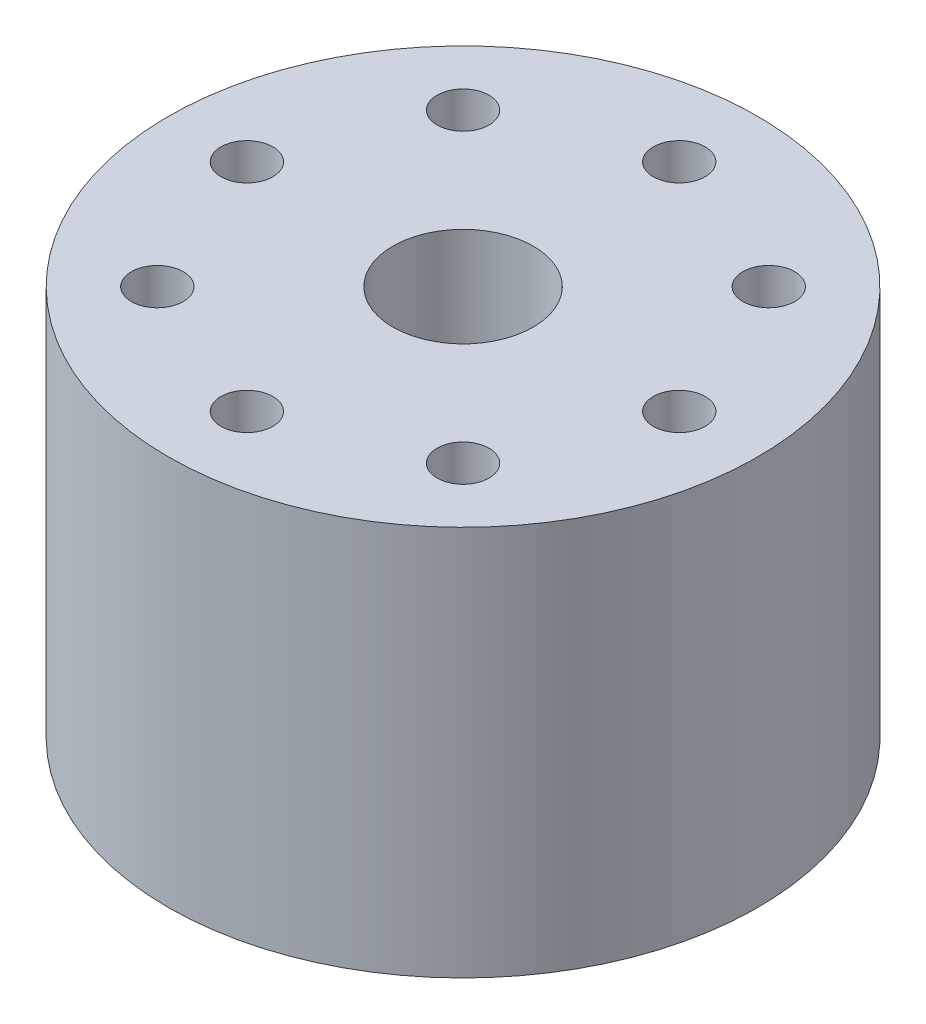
SolidWorks part; units mm, degrees
ref_plane "Front Plane" through (0, 0, 0) normal (0, 0, 1) x (1, 0, 0)
ref_plane "Top Plane" through (0, 0, 0) normal (0, 1, 0) x (1, 0, 0)
ref_plane "Right Plane" through (0, 0, 0) normal (1, 0, 0) x (0, 0, -1)
sketch "Sketch1" plane through (0, 0, 0) normal (0, 1, 0) x (1, 0, 0)
  circle A0 centre (0, 0) radius 37.5
  dimension "D1" = 75
extrude "Outer Cylinder" add sketch "Sketch1" along normal blind 49.65
sketch "Sketch2" plane through (0, 49.65, 0) normal (0, 1, 0) x (1, 0, 0)
  circle A0 centre (0, 0) radius 8.93
  dimension "D1" = 17.86
extrude "NPT Hole" cut sketch "Sketch2" against normal blind 23
sketch "Sketch3" plane through (0, 0, 0) normal (0, -1, 0) x (1, 0, 0)
  circle A0 centre (0, 0) radius 8
  dimension "D1" = 16
extrude "Outer Leaflet Diameter" cut sketch "Sketch3" against normal blind 5
sketch "Sketch4" plane through (0, 0, 0) normal (0, -1, 0) x (1, 0, 0)
  circle A0 centre (0, 0) radius 12
  dimension "D1" = 24
extrude "Depth" cut sketch "Sketch4" against normal blind 3.15
ref_plane "Plane1" through (0, 3.15, 0) normal (0, -1, 0) x (-1, 0, 0)
sketch "Sketch6" plane through (0, 0, 0) normal (0, 0, 1) x (1, 0, 0)
  line L0 (0, 3.15) -> (-8, 3.15)
  line L1 (-12, 3.15) -> (12, 3.15) construction
  line L2 (0, 3.15) -> (0, 14.51)
  line L3 (0, 14.51) -> (-8, 14.51)
  spline S0 degree 2 poles (-8, 14.51) (-12.8, 8.83) (-8, 3.15) knots 0 0 0 1 1 1
revolve "Aortic Root" cut sketch "Sketch6" angle 360 about L2
ref_plane "Plane3" through (0, 26.65, 0) normal (0, 1, 0) x (1, 0, 0)
ref_plane "Plane5" through (0, 14.51, 0) normal (0, -1, 0) x (-1, 0, 0)
sketch "Sketch8" plane through (0, 0, 0) normal (0, 0, 1) x (1, 0, 0)
  line L0 (0, 26.65) -> (0, 14.51)
  line L1 (8.93, 26.65) -> (-8.93, 26.65) construction
  line L2 (-8, 14.51) -> (8, 14.51) construction
  line L3 (0, 14.51) -> (-8, 14.51)
  line L4 (-8, 14.51) -> (-8, 26.65)
  line L5 (-8, 26.65) -> (0, 26.65)
revolve "Ascending Aorta" cut sketch "Sketch8" angle 360 about L0
sketch "Sketch9" plane through (0, 49.65, 0) normal (0, 1, 0) x (1, 0, 0)
  line L0 (0, 0) -> (0, -27.5) construction
  line L1 (0, 0) -> (-19.4454, -19.4454) construction
  circle A0 centre (0, -27.5) radius 3.3
  circle A1 centre (0, 0) radius 27.5
  circle A2 centre (-19.4454, -19.4454) radius 3.3
  circle A3 centre (-27.5, 0) radius 3.3
  circle A4 centre (-19.4454, 19.4454) radius 3.3
  circle A5 centre (0, 27.5) radius 3.3
  circle A6 centre (19.4454, 19.4454) radius 3.3
  circle A7 centre (27.5, 0) radius 3.3
  circle A8 centre (19.4454, -19.4454) radius 3.3
  dimension "D1" = 6.6
  dimension "D3" = 55
  dimension "D2" = 27.5
  dimension "D5" = 45
  dimension "D4" = 8
extrude "Bolt Holes" cut sketch "Sketch9" against normal through all contours A1 A8 | A1 A7 | A1 A6 | A1 A6 | A1 A5 | A1 A5 | A1 A4 | A1 A4 | A1 A3 | A1 A3 | A1 A2 | A1 A2 | A0 A1 | A1 A0 | A1 A8
chamfer "Chamfer1" distance 2 angle 70 1 edges at (-8, 26.65, 0)
equation "\"A\"= 16"
equation "\"Outer Leaflet Diameter\"= \"A\""
equation "\"Aortic Root Height\"= .71 * \"A\""
equation "\"D2@Sketch6\"=\"A\"/2"
equation "\"D3@Sketch6\"= \"A\" / 2"
equation "\"Max Diameter Height\"= \"A\" * ( .71 / 2 )"
equation "\"Max Diameter\"= \"A\" * ( .65 )"
equation "\"D2@Sketch8\"=\"A\"/2"
